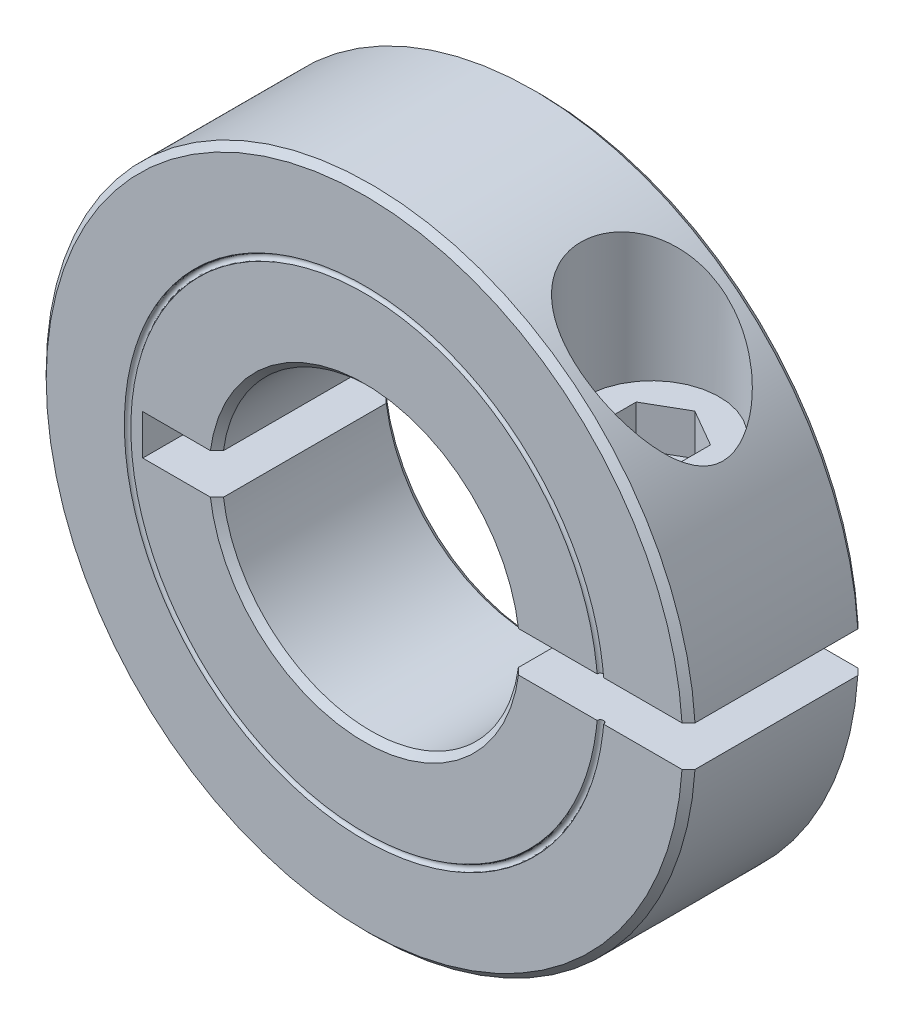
SolidWorks part; units mm, degrees
other "LUMP1"
ref_plane "Front" through (0, 0, 0) normal (0, 0, 1) x (1, 0, 0)
ref_plane "Top" through (0, 0, 0) normal (0, 1, 0) x (1, 0, 0)
ref_plane "Right" through (0, 0, 0) normal (1, 0, 0) x (0, 0, -1)
imported_body "Imported1"
move or copy body "Body-Move/Copy1" bodies to move or copy 101 placed by mates yes
ref_plane "Z Location" through (0, 0, 31.3411) normal (0, 0, 1) x (1, 0, 0)
sketch "Y Location" plane through (0, 0, 31.3411) normal (0, 0, 1) x (1, 0, 0)
  line L0 (0, 0) -> (0, 77.2922) construction
  dimension "BD71" = 77.2922
move or copy body "Body-Move/Copy2" bodies to move or copy 101 placed by mates yes
other "Distance1" parameters "D1"=5.1562
